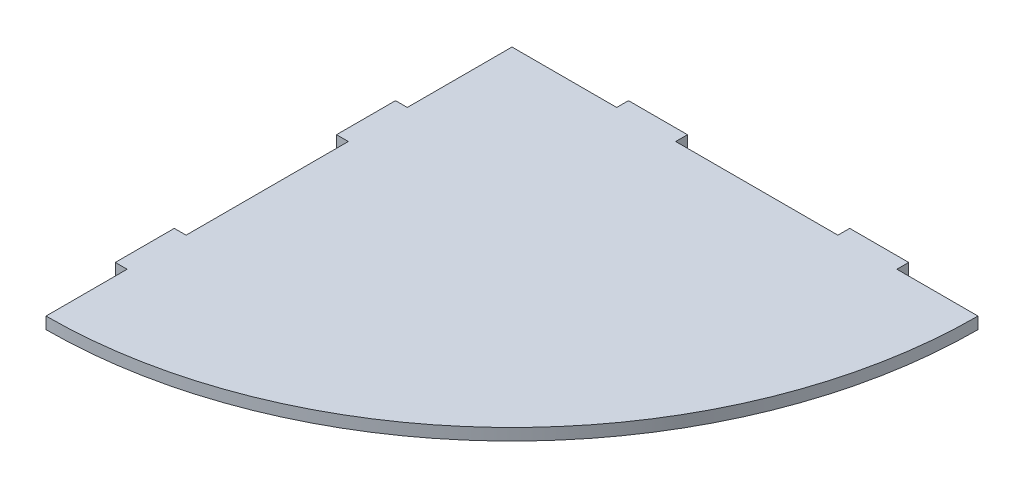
SolidWorks part; units mm, degrees
ref_plane "Alzado" through (0, 0, 0) normal (0, 0, 1) x (1, 0, 0)
ref_plane "Planta" through (0, 0, 0) normal (0, 1, 0) x (1, 0, 0)
ref_plane "Vista lateral" through (0, 0, 0) normal (1, 0, 0) x (0, 0, -1)
sketch "Croquis1" plane through (0, 0, 0) normal (0, 1, 0) x (1, 0, 0)
  line L0 (0, 0) -> (35.5, 0)
  line L1 (35.5, 0) -> (35.5, 4)
  line L2 (35.5, 4) -> (55.5, 4)
  line L3 (55.5, 4) -> (55.5, 0)
  line L4 (55.5, 0) -> (110.5, 0)
  line L5 (110.5, 0) -> (110.5, 4)
  line L6 (110.5, 4) -> (130.5, 4)
  line L7 (130.5, 4) -> (130.5, 0)
  line L8 (130.5, 0) -> (158, 0)
  line L9 (0, 0) -> (0, -35.5)
  line L10 (0, -35.5) -> (-4, -35.5)
  line L11 (-4, -35.5) -> (-4, -55.5)
  line L12 (-4, -55.5) -> (0, -55.5)
  line L13 (0, -55.5) -> (0, -110.5)
  line L14 (0, -110.5) -> (-4, -110.5)
  line L15 (-4, -110.5) -> (-4, -130.5)
  line L16 (-4, -130.5) -> (0, -130.5)
  line L17 (0, -130.5) -> (0, -158)
  arc A0 (158, 0) -> (0, -158) centre (0, 0) cw
  point P21 (45.5, 4)
  point P22 (-4, -120.5)
  point P23 (-4, -45.5)
  point P25 (120.5, 4)
extrude "Saliente-Extruir1" add sketch "Croquis1" along normal blind 4 contours A0 L8 L7 L6 L5 L4 L3 L2 L1 L0 L9 L10 L11 L12 L13 L14 L15 L16 L17
equation "\"totalShelves\" = 1'Numero de estantes"
equation "\"shelfSpacing\"= 25cm'Distancia entre estantes"
equation "\"thickness\"= 4mm'Espesor del material"
equation "\"shelfRadius\"= 15cm'Radio de la repisa "
equation "\"supportWidth\"= 3cm'ancho del soporte"
equation "\"holderWidth\"= 2cm'ancho de la estructura"
equation "\"tabSlotLength\"= 20mm'Largo de las pestañas "
equation "\"totalHeight\"= ( \"shelfSpacing\" * \"totalShelves\" ) + ( \"shelfSpacing\" * 0.5 ) + \"supportWidth\" * ( \"totalShelves\" + 1 )'Altura total"
equation "\"D1@Croquis1\"=\"thickness\""
equation "\"D2@Croquis1\"=\"tabSlotLength\""
equation "\"D8@Croquis1\"=\"shelfRadius\"/2"
equation "\"D1@Saliente-Extruir1\"=\"thickness\""
equation "\"D3@Croquis1\"=\"shelfRadius\"/4"
equation "\"D4@Croquis1\"=\"shelfRadius\"/2"
equation "\"D5@Croquis1\"=\"shelfRadius\"/4"
equation "\"D6@Croquis1\"=\"shelfRadius\"+(\"holderWidth\"-\"thickness\")*0.5"
